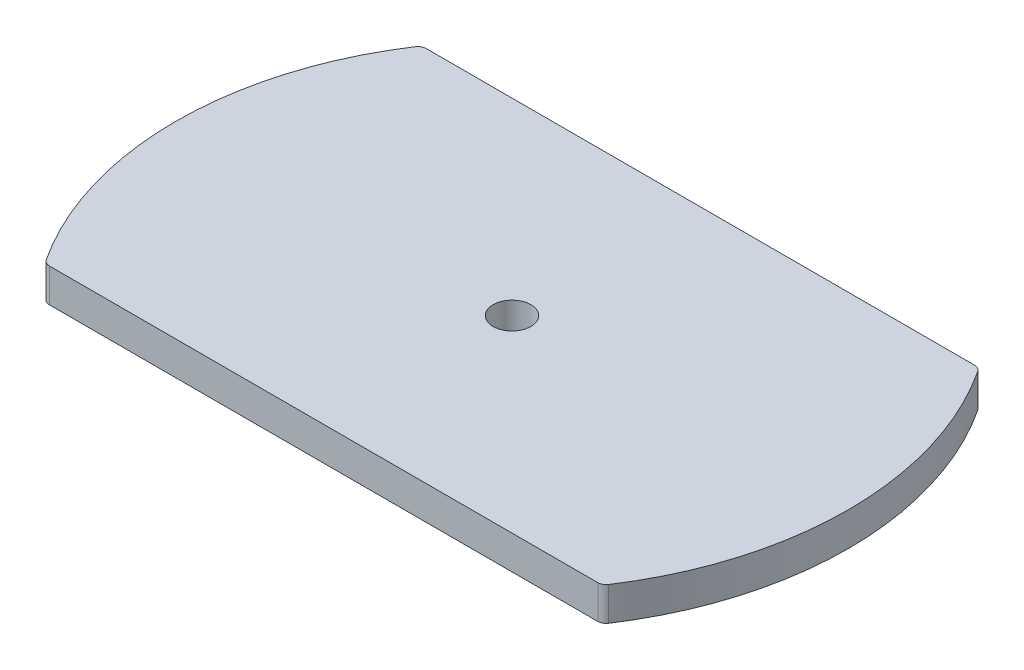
SolidWorks part; units mm, degrees
ref_plane "Front Plane" through (0, 0, 0) normal (0, 0, 1) x (1, 0, 0)
ref_plane "Top Plane" through (0, 0, 0) normal (0, 1, 0) x (1, 0, 0)
ref_plane "Right Plane" through (0, 0, 0) normal (1, 0, 0) x (0, 0, -1)
sketch "Sketch1" plane through (0, 0, 0) normal (0, 1, 0) x (1, 0, 0)
  line L1 (-70.485, -35.56) -> (70.485, -35.56)
  line L2 (-73.66, -32.385) -> (-73.66, 32.385)
  line L3 (-70.485, 35.56) -> (70.485, 35.56)
  line L4 (73.66, -32.385) -> (73.66, 32.385)
  line L5 (-73.66, -35.56) -> (73.66, 35.56) construction
  line L6 (-73.66, 35.56) -> (73.66, -35.56) construction
  circle A0 centre (0, 0) radius 3.5719
  arc A1 (-70.485, -35.56) -> (-73.66, -32.385) centre (-70.485, -32.385) cw
  arc A2 (70.485, -35.56) -> (73.66, -32.385) centre (70.485, -32.385) ccw
  arc A3 (70.485, 35.56) -> (73.66, 32.385) centre (70.485, 32.385) cw
  arc A4 (-73.66, 32.385) -> (-70.485, 35.56) centre (-70.485, 32.385) cw
  point P0 (0, 0)
  dimension "D3" = 7.1437
  dimension "D4" = 3.175
  dimension "D1" = 147.32
  dimension "D2" = 71.12
extrude "Boss-Extrude1" add sketch "Sketch1" along normal blind 6.35
sketch "Sketch2" plane through (0, 0, 0) normal (0, 1, 0) x (1, 0, 0)
  circle A0 centre (0, 0) radius 63.5
  circle A1 centre (0, 0) radius 88.9
  dimension "D1" = 127
  dimension "D2" = 177.8
extrude "Cut-Extrude2" cut sketch "Sketch2" along normal through all
fillet "Fillet1" radius 1.5875 4 edges at (52.6093, 3.175, 35.56) (-52.6093, 3.175, 35.56) (-52.6093, 3.175, -35.56) (52.6093, 3.175, -35.56)
